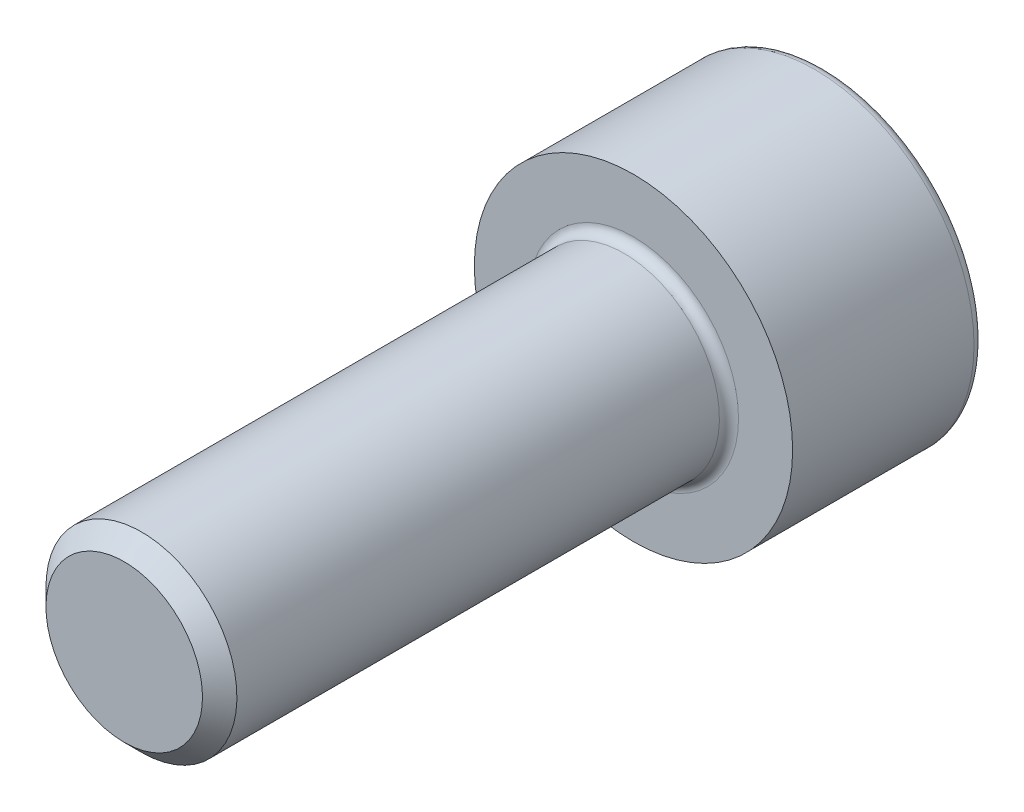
SolidWorks part; units mm, degrees
ref_plane "Plan1" through (0, 0, 0) normal (0, 0, 1) x (1, 0, 0)
ref_plane "Plan2" through (0, 0, 0) normal (0, 1, 0) x (1, 0, 0)
ref_plane "Plan3" through (0, 0, 0) normal (1, 0, 0) x (0, 0, -1)
sketch "Sketch1" plane through (0, 0, 0) normal (1, 0, 0) x (0, 0, -1)
  line L0 (6, 0) -> (-16, 0) construction
  line L1 (6, 0) -> (6, 5)
  line L2 (6, 5) -> (0, 5)
  line L3 (0, 5) -> (0, 3)
  line L4 (0, 3) -> (-16, 3)
  line L5 (-16, 3) -> (-16, 0)
  line L6 (-16, 0) -> (6, 0)
  line L7 (6, 0) -> (5, 0) construction
  dimension "DK" = 10
  dimension "L" = 16
  dimension "K" = 6
  dimension "D" = 6
  dimension "P" = 1
revolve "Base-Revolve" add sketch "Sketch1"
chamfer "Chamfer1" distance 0.5412 angle 45 1 edges at (0, 3, 16)
fillet "Fillet1" radius 0.3 2 edges at (0, 5, -6) (0, 3, 0)
hole_wizard "Hole1" positions "Sketch3" profile "Sketch2" legacy
sketch "Sketch3" plane through (0, 0, -6) normal (0, 0, -1) x (-1, 0, 0)
  circle A0 centre (0, 0) radius 5 construction
  point P0 (0, 0)
sketch "Sketch2" plane through (0, 0, -6) normal (1, 0, 0) x (0, 1, 0)
  line L0 (0, 0) -> (0, 4.4434)
  line L1 (0, 4.4434) -> (2.5, 3)
  line L2 (2.5, 3) -> (2.5, 0)
  line L4 (2.5, 0) -> (0, 0)
  line L6 (0, 4.4434) -> (-2.5, 3) construction
  line L7 (0, -4.2442) -> (0, 117.3081) construction
  dimension "Diameter" = 5
  dimension "Depth" = 3
  dimension "Drill Angle" = 120
sketch "Sketch4" plane through (0, 0, -6) normal (0, 0, -1) x (-1, 0, 0)
  line L0 (0, -2.5) -> (0, 2.5) construction
  line L1 (2.8868, 0) -> (-2.8868, 0) construction
  line L2 (1.4434, 2.5) -> (-1.4434, 2.5)
  line L3 (-1.4434, 2.5) -> (-2.8868, 0)
  line L4 (-2.8868, 0) -> (-1.4434, -2.5)
  line L5 (-1.4434, -2.5) -> (1.4434, -2.5)
  line L6 (1.4434, -2.5) -> (2.8868, 0)
  line L7 (2.8868, 0) -> (1.4434, 2.5)
  dimension "D1" = 120
  dimension "S" = 5
extrude "Cut-Extrude1" cut sketch "Sketch4" against normal blind 3
equation "\"K@Sketch1\" = \"D@Sketch1\""
equation "\"D1@Fillet1\" = \"D@Sketch1\"*0.05"
equation "\"S@Sketch4\" = \"Diameter@Sketch2\""
equation "\"T@Cut-Extrude1\" = \"Depth@Sketch2\""
equation "\"D1@Cosmetic_Thread1\" = \"D@Sketch1\"-(1.0825*\"P@Sketch1\")"
equation "\"D1@Chamfer1\" = (\"D@Sketch1\"-\"D1@Cosmetic_Thread1\")/2"
